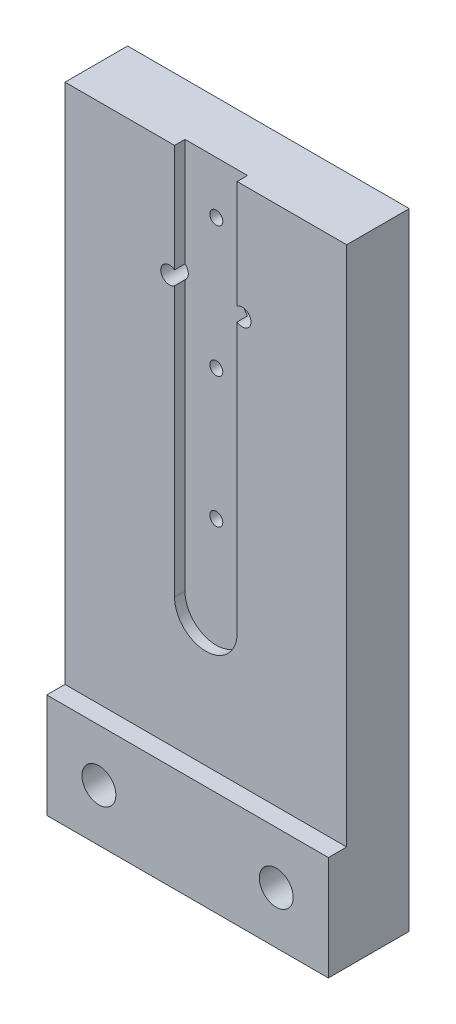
SolidWorks part; units mm, degrees
ref_plane "前视基准面" through (0, 0, 0) normal (0, 0, 1) x (1, 0, 0)
ref_plane "上视基准面" through (0, 0, 0) normal (0, 1, 0) x (1, 0, 0)
ref_plane "右视基准面" through (0, 0, 0) normal (1, 0, 0) x (0, 0, -1)
sketch "草图1" plane through (0, 0, 0) normal (0, 0, 1) x (1, 0, 0)
  line L0 (0, 0) -> (54, 0)
  line L1 (0, 120) -> (54, 120)
  line L2 (0, 0) -> (0, 120)
  line L3 (54, 0) -> (54, 120)
  circle A0 centre (27, 110) radius 1.25
  circle A1 centre (27, 85) radius 1.25
  circle A2 centre (27, 60) radius 1.25
  circle A3 centre (10, 10) radius 3.25
  circle A4 centre (44, 10) radius 3.25
  circle A5 centre (20, 98) radius 1.65
  circle A6 centre (34, 98) radius 1.65
extrude "凸台-拉伸1" add sketch "草图1" along normal blind 15.5
sketch "草图2" plane through (54, 0, 0) normal (1, 0, 0) x (0, 0, -1)
  line L0 (-15.5, 0) -> (-15.5, 20)
  line L1 (-12, 20) -> (-12, 120)
  line L2 (0, 0) -> (0, 120)
  line L3 (-15.5, 0) -> (0, 0)
  line L4 (-15.5, 20) -> (-12, 20)
  line L5 (-12, 120) -> (0, 120)
extrude "切除-拉伸1" cut sketch "草图2" against normal through all flip side to cut
sketch "草图5" plane through (0, 0, 12) normal (0, 0, 1) x (1, 0, 0)
  line L0 (21, 45) -> (21, 96.2679)
  line L1 (33, 45) -> (33, 96.2679)
  line L2 (21, 99.3124) -> (21, 120)
  line L3 (33, 99.7321) -> (33, 120)
  line L4 (21, 99.3124) -> (21, 96.2679)
  line L5 (33, 99.7321) -> (33, 96.2679)
  line L6 (21, 120) -> (33, 120)
  arc A0 (21, 45) -> (33, 45) centre (27, 45) ccw
extrude "切除-拉伸2" cut sketch "草图5" against normal blind 2
